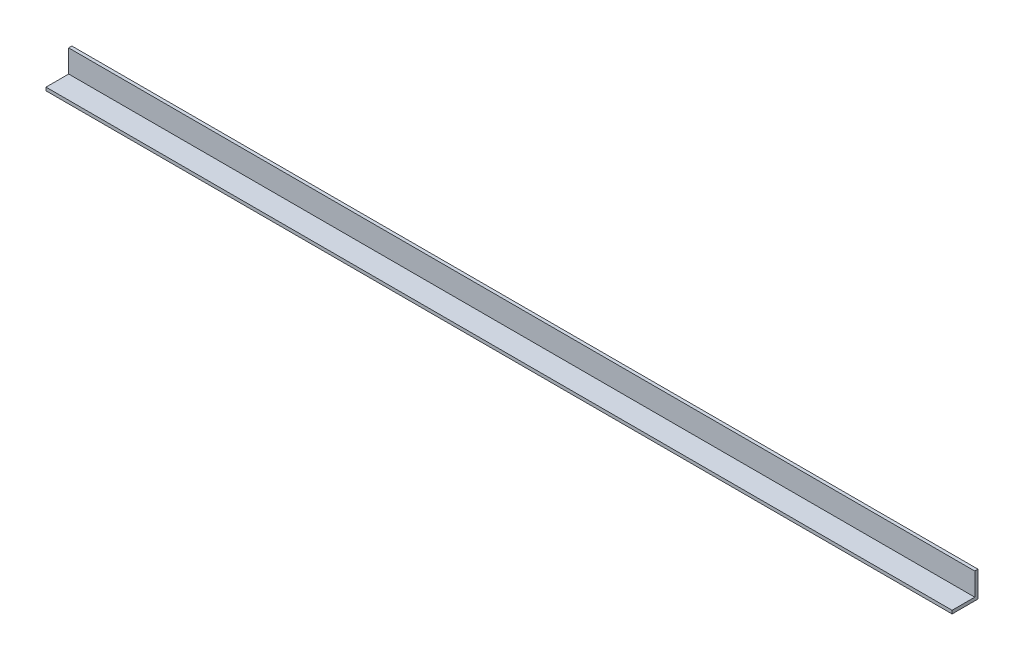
SolidWorks part; units mm, degrees
ref_plane "Front Plane" through (0, 0, 0) normal (0, 0, 1) x (1, 0, 0)
ref_plane "Top Plane" through (0, 0, 0) normal (0, 1, 0) x (1, 0, 0)
ref_plane "Right Plane" through (0, 0, 0) normal (1, 0, 0) x (0, 0, -1)
sketch "Sketch1" plane through (0, 0, 0) normal (0, 1, 0) x (1, 0, 0)
  line L1 (-444.5, 12.7) -> (444.5, 12.7)
  line L2 (-444.5, 12.7) -> (-444.5, -12.7)
  line L3 (-444.5, -12.7) -> (444.5, -12.7)
  line L4 (444.5, 12.7) -> (444.5, -12.7)
  line L5 (-444.5, 12.7) -> (444.5, -12.7) construction
  line L6 (-444.5, -12.7) -> (444.5, 12.7) construction
  point P0 (0, 0)
  dimension "D1" = 889
  dimension "D2" = 25.4
extrude "Boss-Extrude1" add sketch "Sketch1" along normal blind 3.175
sketch "Sketch2" plane through (0, 3.175, 0) normal (0, 1, 0) x (1, 0, 0)
  line L0 (-444.5, 12.7) -> (-444.5, 9.525)
  line L1 (-444.5, 12.7) -> (-444.5, -12.7) construction
  line L2 (-444.5, 9.525) -> (444.5, 9.525)
  line L3 (444.5, -12.7) -> (444.5, 12.7) construction
  line L4 (444.5, 9.525) -> (444.5, 12.7)
  line L5 (444.5, 12.7) -> (-444.5, 12.7)
  dimension "D1" = 3.175
extrude "Boss-Extrude2" add sketch "Sketch2" along normal blind 22.225
